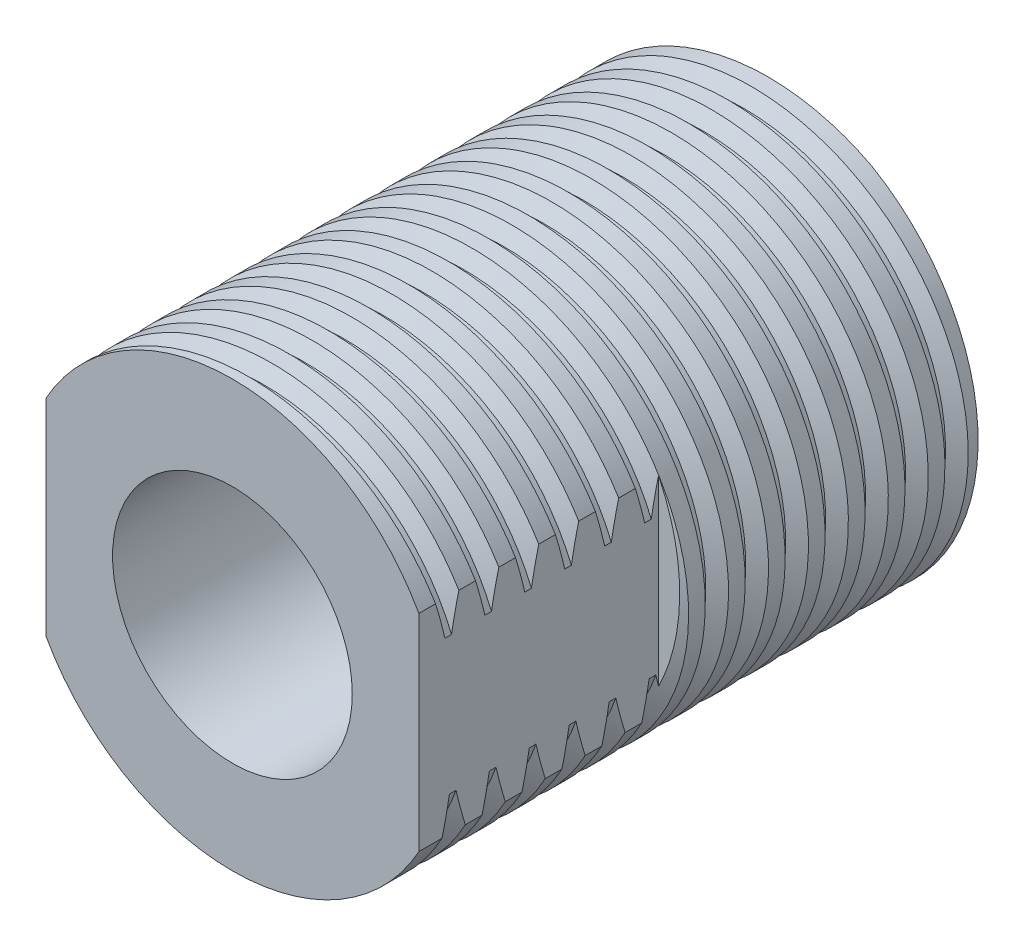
SolidWorks part; units mm, degrees
ref_plane "Front" through (0, 0, 0) normal (0, 0, 1) x (1, 0, 0)
ref_plane "Top" through (0, 0, 0) normal (0, 1, 0) x (1, 0, 0)
ref_plane "Right" through (0, 0, 0) normal (1, 0, 0) x (0, 0, -1)
sketch "Sketch1" plane through (0, 0, 0) normal (0, 0, 1) x (1, 0, 0)
  circle A1 centre (0, 0) radius 7 construction
  circle A2 centre (0, 0) radius 3.1 construction
  circle A3 centre (0, 0) radius 1.5875 construction
  circle A4 centre (0, 0) radius 8 construction
  dimension "D1" = 3.175
  dimension "D2" = 6.2
  dimension "D3" = 14
  dimension "D4" = 16
sketch "Sketch2" plane through (0, 0, 0) normal (0, 0, 1) x (1, 0, 0)
  circle A0 centre (0, 0) radius 8 construction
  circle A1 centre (0, 0) radius 8
extrude "Boss-Extrude1" add sketch "Sketch2" along normal blind 20
thread "Thread1" pitch 1 start angle 0, offset 0, length 20, pitch 1.5, diameter 16
ref_plane "Plane1" through (-8, 0, 20) normal (0, -1, 0) x (-1, 0, 0)
sketch "Thread Profile1" plane through (-8, 0, 20) normal (0, -1, 0) x (-1, 0, 0)
  line L0 (0, 0) -> (0, 1) construction
  line L11 (0, 0) -> (0, 0.875)
  line L12 (0, 0.875) -> (-0.5413, 0.5625)
  line L13 (-0.5413, 0.5625) -> (-0.5413, 0.3125)
  line L15 (-0.5413, 0.3125) -> (0, 0)
  line L17 (-0.5413, 0.4375) -> (0, 0.4375) construction
  point P2 (0, 0)
  dimension "Pitch" = 1
  dimension "Profile_Angle" = 60
  dimension "Profile_Land" = 0.25
  dimension "Profile_Height" = 0.5413
sketch "Sketch7" plane through (0, 0, 20) normal (0, 0, 1) x (1, 0, 0)
  line L0 (-7, 3.873) -> (-7, -3.873)
  line L1 (7, 3.873) -> (7, -3.873)
  line L2 (-7, 0) -> (7, 0) construction
  circle A0 centre (0, 0) radius 8 construction
  arc A1 (-7, 3.873) -> (-7, -3.873) centre (0, 0) ccw
  arc A2 (7, -3.873) -> (7, 3.873) centre (0, 0) ccw
  point P2 (-3.873, -7)
  point P9 (0, 0)
  point P10 (6.0047, 0)
  point P11 (0, 0)
  dimension "D1" = 14
sketch "Sketch9" plane through (0, 0, 20) normal (0, 0, 1) x (1, 0, 0)
  line L1 (7, 3.873) -> (7, -3.873)
  line L2 (7, 3.873) -> (7, -3.873)
  line L3 (-7, -3.873) -> (-7, 3.873)
  line L4 (-7, -3.873) -> (-7, 3.873)
  arc A1 (7, -3.873) -> (7, 3.873) centre (0, 0) ccw
  arc A2 (7, -3.873) -> (7, 3.873) centre (0, 0) ccw
  arc A3 (-7, 3.873) -> (-7, -3.873) centre (0, 0) ccw
  arc A4 (-7, 3.873) -> (-7, -3.873) centre (0, 0) ccw
  dimension "D1" = 0
  dimension "D2" = 0
extrude "Cut-Extrude4" cut sketch "Sketch9" against normal blind 9
hole_wizard "1/8 (0.125) Diameter Hole1" positions "Sketch10" profile "Sketch11" hole size "1/8" standard "ANSI Inch"
sketch "Sketch10" plane through (0, 0, 0) normal (0, 0, -1) x (-1, 0, 0)
  point P0 (0, 0)
sketch "Sketch11" plane through (0, 0, 0) normal (1, 0, 0) x (0, 1, 0)
  line L0 (0, 0) -> (0, 20)
  line L1 (0, 20) -> (1.5875, 20)
  line L2 (1.5875, 20) -> (1.5875, 0)
  line L5 (1.5875, 0) -> (0, 0)
  line L11 (0, -6.35) -> (0, 107.95) construction
  dimension "Thru Hole Dia." = 3.175
  dimension "Thru Hole Depth" = 20
sketch "Sketch12" plane through (0, 0, 20) normal (0, 0, 1) x (1, 0, 0)
  circle A0 centre (0, 0) radius 3.1 construction
  circle A1 centre (0, 0) radius 3.1
extrude "Cut-Extrude5" cut sketch "Sketch12" against normal blind 15
hole_wizard "M10x1.0 Tapped Hole1" positions "Sketch13" profile "Sketch14" tap size "M10x1.0" standard "ANSI Metric"
sketch "Sketch13" plane through (0, 0, 20) normal (0, 0, 1) x (1, 0, 0)
  point P0 (0, 0)
sketch "Sketch14" plane through (0, 0, 20) normal (1, 0, 0) x (0, -1, 0)
  line L0 (0, 0) -> (0, 12.7039)
  line L1 (0, 12.7039) -> (4.5, 10)
  line L2 (4.5, 10) -> (4.5, 0)
  line L5 (4.5, 0) -> (0, 0)
  line L10 (0, 12.7039) -> (-4.5, 10) construction
  line L11 (0, -6.35) -> (0, 107.95) construction
  dimension "Tap Drill Dia." = 9
  dimension "Tap Drill Depth" = 10
  dimension "Drill Angle" = 118
